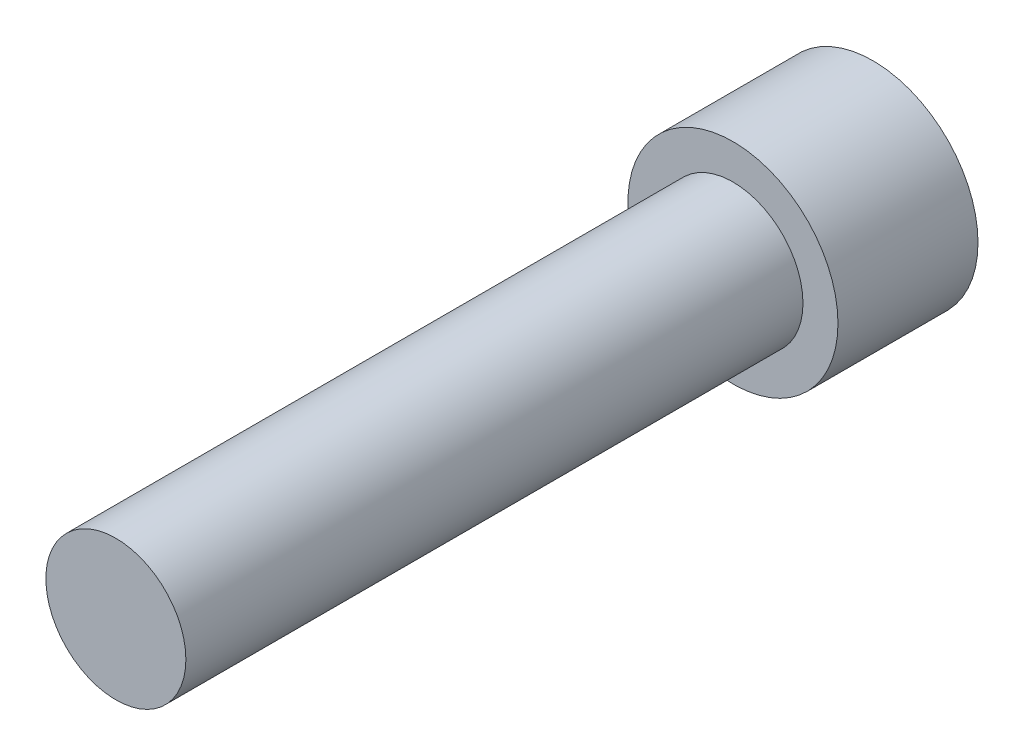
SolidWorks part; units mm, degrees
ref_plane "Front Plane" through (0, 0, 0) normal (0, 0, 1) x (1, 0, 0)
ref_plane "Top Plane" through (0, 0, 0) normal (0, 1, 0) x (1, 0, 0)
ref_plane "Right Plane" through (0, 0, 0) normal (1, 0, 0) x (0, 0, -1)
sketch "Sketch6" plane through (0, 0, 0) normal (1, 0, 0) x (0, 0, -1)
  line L0 (-34.925, 0) -> (22.525, 0) construction
  line L1 (6.538, 0) -> (-6.538, 0) construction
  line L2 (-34.925, 0) -> (-34.925, -3.9624)
  line L3 (-34.925, -3.9624) -> (0, -3.9624)
  line L4 (0, 6.538) -> (0, -6.538) construction
  line L5 (0, -3.9624) -> (0, -5.9436)
  line L6 (0, -5.9436) -> (7.9248, -5.9436)
  line L7 (7.9248, -5.9436) -> (7.9248, 0)
  line L8 (7.9248, 0) -> (-34.925, 0)
  dimension "L" = 34.925
  dimension "H" = 7.9248
  dimension "A" = 11.8872
  dimension "D" = 7.9248
revolve "Revolve1" add sketch "Sketch6" angle 360 about L0
sketch "Sketch7" plane through (0, 0, -7.9248) normal (0, 0, -1) x (-1, 0, 0)
  line L2 (-3.175, 1.8331) -> (-3.175, -1.8331)
  line L4 (-3.175, -1.8331) -> (0, -3.6662)
  line L5 (0, -3.6662) -> (3.175, -1.8331)
  line L6 (3.175, -1.8331) -> (3.175, 1.8331)
  line L7 (3.175, 1.8331) -> (0, 3.6662)
  line L8 (0, 3.6662) -> (-3.175, 1.8331)
  circle A0 centre (0, 0) radius 3.175 construction
  dimension "J" = 6.35
extrude "HEX" cut sketch "Sketch7" against normal blind 4.826
